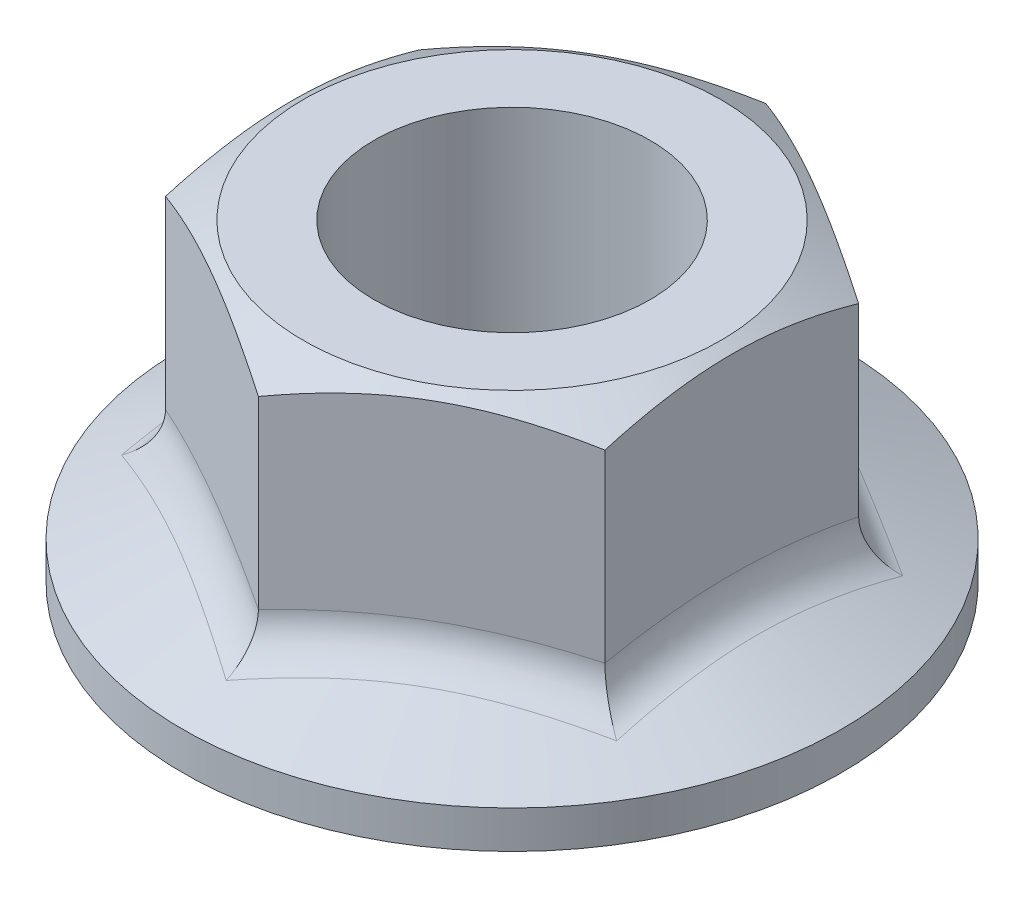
SolidWorks part; units mm, degrees
ref_plane "Front Plane" through (0, 0, 0) normal (0, 0, 1) x (1, 0, 0)
ref_plane "Top Plane" through (0, 0, 0) normal (0, 1, 0) x (1, 0, 0)
ref_plane "Right Plane" through (0, 0, 0) normal (1, 0, 0) x (0, 0, -1)
sketch "BaseNutSke" plane through (0, 0, 0) normal (0, 1, 0) x (1, 0, 0)
  line L1 (0, 8.0829) -> (-7, 4.0415)
  line L2 (-7, 4.0415) -> (-7, -4.0415)
  line L3 (-7, -4.0415) -> (0, -8.0829)
  line L4 (0, -8.0829) -> (7, -4.0415)
  line L5 (7, -4.0415) -> (7, 4.0415)
  line L6 (7, 4.0415) -> (0, 8.0829)
  circle A0 centre (0, 0) radius 7 construction
  dimension "Width" = 14
extrude "BaseNut" add sketch "BaseNutSke" along normal blind 10
sketch "FlangeSke" plane through (0, 0, 0) normal (1, 0, 0) x (0, 0, -1)
  line L0 (0, 0) -> (10.5, 0)
  line L1 (10.5, 0) -> (10.5, 1.2)
  line L2 (10.5, 1.2) -> (4.0415, 4.2117)
  line L3 (4.0415, 4.2117) -> (0, 4.2117)
  line L4 (0, 4.2117) -> (0, 0)
  line L5 (0, 0) -> (0, 18.4813) construction
  dimension "Flange_diameter" = 21
  dimension "Ang" = 25
  dimension "Flange_thickness" = 1.2
revolve "Flange" add sketch "FlangeSke" angle 360 about L5
sketch "HoleSke" plane through (0, 0, 0) normal (0, 1, 0) x (1, 0, 0)
  circle A0 centre (0, 0) radius 5 construction
  circle A1 centre (0, 0) radius 4.4
  dimension "Diameter" = 10
  dimension "Tap_drill" = 8.8
extrude "TappedHole" cut sketch "HoleSke" along normal through all
sketch "CutChamferSke" plane through (0, 0, 0) normal (1, 0, 0) x (0, 0, -1)
  line L0 (6.65, 10) -> (8.0829, 10)
  line L1 (8.0829, 10) -> (8.0829, 9.1727)
  line L2 (8.0829, 9.1727) -> (6.65, 10)
  line L3 (0, 0) -> (0, 18.9818) construction
  dimension "D1" = 30
  dimension "D2" = 13.3
revolve "CutChamfer" cut sketch "CutChamferSke" angle 360 about L3
fillet "Fillet" radius 1.4 6 edges at (5.1284, 2.7164, 5.122) (-1.8716, 2.7164, 7.0024) (-5.1284, 2.7164, -5.122) (1.8716, 2.7164, -7.0024)
sketch "ThdSchSke" plane through (0, 0, 0) normal (1, 0, 0) x (0, 0, -1)
  line L0 (0, -18.1994) -> (0, 18.1994) construction
  line L1 (-3.7072, 0.3464) -> (-3.7072, -0.3464)
  line L2 (-3.7072, -0.3464) -> (-4.4, -0.3464)
  line L3 (-4.4, -0.3464) -> (-5, 0)
  line L4 (-5, 0) -> (-4.4, 0.3464)
  line L5 (-4.4, 0.3464) -> (-3.7072, 0.3464)
  dimension "D1" = 10
  dimension "D2" = 8.8
revolve "ThreadSchematic" [suppressed] cut sketch "ThdSchSke" angle 360 about L0
pattern_linear "ThdSchPat" [suppressed] count 9 along (0, 1, 0)
equation "\"D2@ThreadCosmetic\" = \"Diameter@HoleSke\""
equation "\"D2@CutChamferSke\" = \"Width@BaseNutSke\"*0.95"
equation "\"D2@ThdSchSke\" = \"Tap_drill@HoleSke\""
equation "\"D1@ThdSchSke\" = \"Diameter@HoleSke\""
equation "\"D1@ThdSchPat\" =  int( \"Height@BaseNut\" / \"Advance@ThdSchPat\" ) +1"
